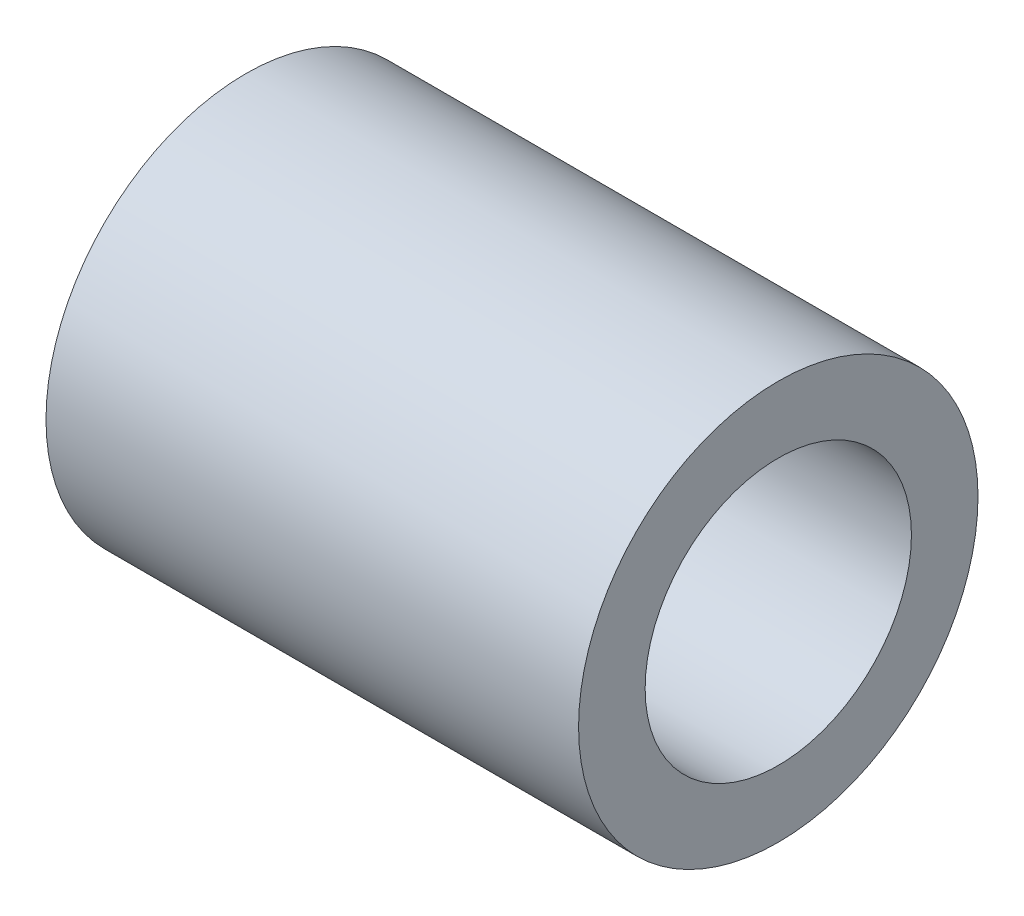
SolidWorks part; units mm, degrees
ref_plane "Front Plane" through (0, 0, 0) normal (0, 0, 1) x (1, 0, 0)
ref_plane "Top Plane" through (0, 0, 0) normal (0, 1, 0) x (1, 0, 0)
ref_plane "Right Plane" through (0, 0, 0) normal (1, 0, 0) x (0, 0, -1)
sketch "Sketch1" plane through (0, 0, 0) normal (1, 0, 0) x (0, 0, -1)
  circle A0 centre (0, 0) radius 4.5
  circle A1 centre (0, 0) radius 3
  dimension "D1" = 9
  dimension "D2" = 6
extrude "Boss-Extrude1" add sketch "Sketch1" along normal blind 12
